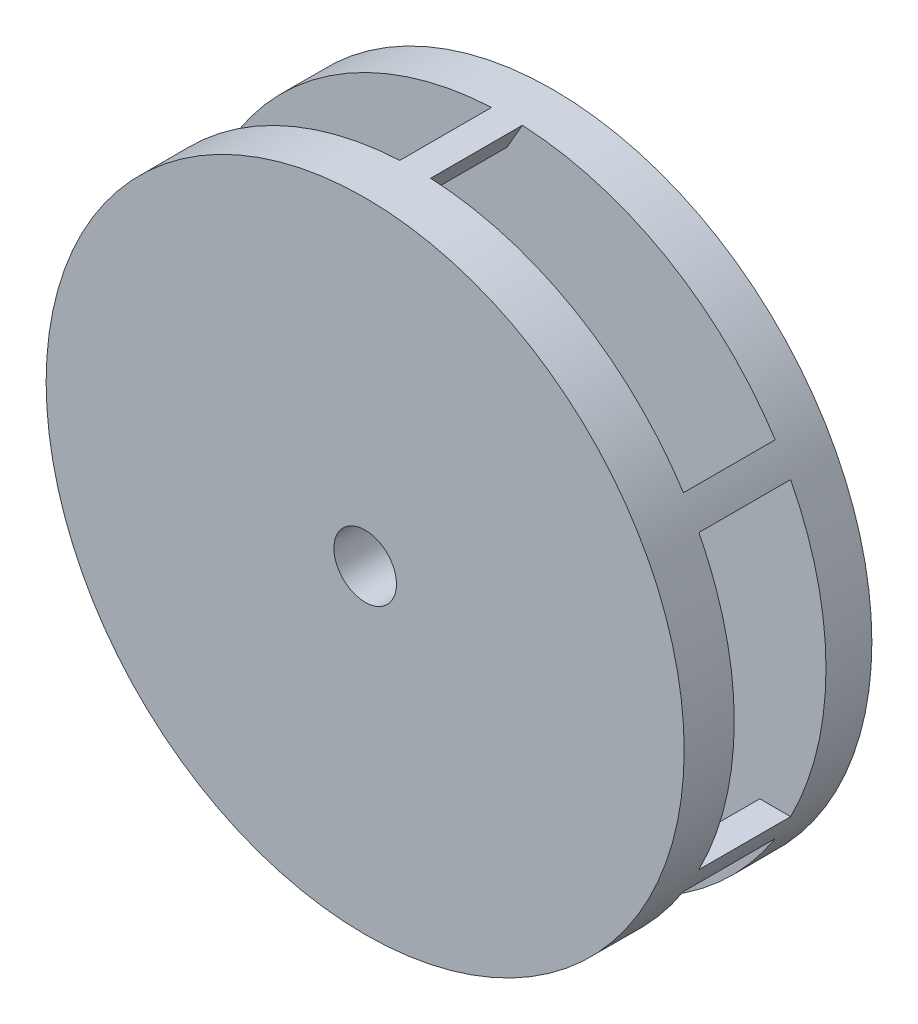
SolidWorks part; units mm, degrees
ref_plane "Alzado" through (0, 0, 0) normal (0, 0, 1) x (1, 0, 0)
ref_plane "Planta" through (0, 0, 0) normal (0, 1, 0) x (1, 0, 0)
ref_plane "Vista lateral" through (0, 0, 0) normal (1, 0, 0) x (0, 0, -1)
sketch "Croquis1" plane through (0, 0, 0) normal (0, 0, 1) x (1, 0, 0)
  circle A0 centre (0, 0) radius 76.5
  dimension "D1" = 153
extrude "Saliente-Extruir1" add sketch "Croquis1" along normal blind 45
sketch "Croquis3" plane through (0, 0, 0) normal (0, 0, -1) x (-1, 0, 0)
  circle A0 centre (0, 0) radius 30.5
  circle A1 centre (0, 0) radius 25.5
  dimension "D1" = 51
  dimension "D2" = 61
extrude "Saliente-Extruir2" add sketch "Croquis3" along normal blind 15
sketch "Croquis4" plane through (0, 0, 0) normal (0, 1, 0) x (1, 0, 0)
  line L0 (0, 0) -> (0, 26.0584) construction
  line L2 (-30.5, 0) -> (-65.5, 0)
  line L3 (76.5, 0) -> (-76.5, 0) construction
  line L4 (-30.5, 0) -> (-30.5, 9)
  line L5 (-30.5, 15) -> (-30.5, 0) construction
  spline S0 degree 2 poles (-65.5, 0) (-38.5214, 2.2767) (-30.5, 9) knots 0 0 0 0.452792 0.452792 0.452792
  dimension "D1" = 35
  dimension "D2" = 9
revolve "Revolución1" add sketch "Croquis4" angle 360 about L0
ref_plane "Plano1" through (38.25, -66.2509, 0) normal (0.5, -0.866, 0) x (0, 0, -1)
sketch "Croquis6" plane through (38.25, -66.2509, 0) normal (0.5, -0.866, 0) x (0, 0, -1)
  line L2 (-11, 0) -> (-11, 35)
  line L3 (-11, 35) -> (-33, 35)
  line L4 (-33, 35) -> (-33, -35)
  line L5 (-33, -35) -> (-11, -35)
  line L6 (-11, -35) -> (-11, 0)
  dimension "D1" = 11
  dimension "D2" = 22
  dimension "D3" = 35
  dimension "D4" = 70
extrude "Cortar-Extruir1" cut sketch "Croquis6" against normal up to next
ref_plane "Plano2" through (38.25, 66.2509, 0) normal (0.5, 0.866, 0) x (0, 0, -1)
sketch "Croquis7" plane through (38.25, 66.2509, 0) normal (0.5, 0.866, 0) x (0, 0, -1)
  line L1 (-11, 0) -> (-11, 35)
  line L2 (-11, 35) -> (-33, 35)
  line L3 (-33, 35) -> (-33, -35)
  line L4 (-33, -35) -> (-11, -35)
  line L5 (-11, -35) -> (-11, 0)
  dimension "D1" = 11
  dimension "D2" = 22
  dimension "D3" = 35
  dimension "D4" = 70
extrude "Cortar-Extruir2" cut sketch "Croquis7" against normal blind 174
ref_plane "Plano3" through (76.5, 0, 0) normal (1, 0, 0) x (0, 0, -1)
sketch "Croquis8" plane through (76.5, 0, 0) normal (1, 0, 0) x (0, 0, -1)
  line L1 (-11, 0) -> (-11, 35)
  line L2 (-11, 35) -> (-33, 35)
  line L3 (-33, 35) -> (-33, -35)
  line L4 (-33, -35) -> (-11, -35)
  line L5 (-11, -35) -> (-11, 0)
  dimension "D1" = 11
  dimension "D2" = 22
  dimension "D3" = 35
  dimension "D4" = 70
extrude "Cortar-Extruir3" cut sketch "Croquis8" against normal blind 153
sketch "Croquis9" plane through (0, 0, 0) normal (0, 0, -1) x (-1, 0, 0)
  circle A0 centre (0, 0) radius 25.5
  dimension "D1" = 51
extrude "Cortar-Extruir4" cut sketch "Croquis9" against normal up to next
sketch "Croquis10" plane through (0, 0, 45) normal (0, 0, 1) x (1, 0, 0)
  circle A0 centre (0, 0) radius 7.5
  dimension "D1" = 15
extrude "Cortar-Extruir5" cut sketch "Croquis10" against normal up to next
